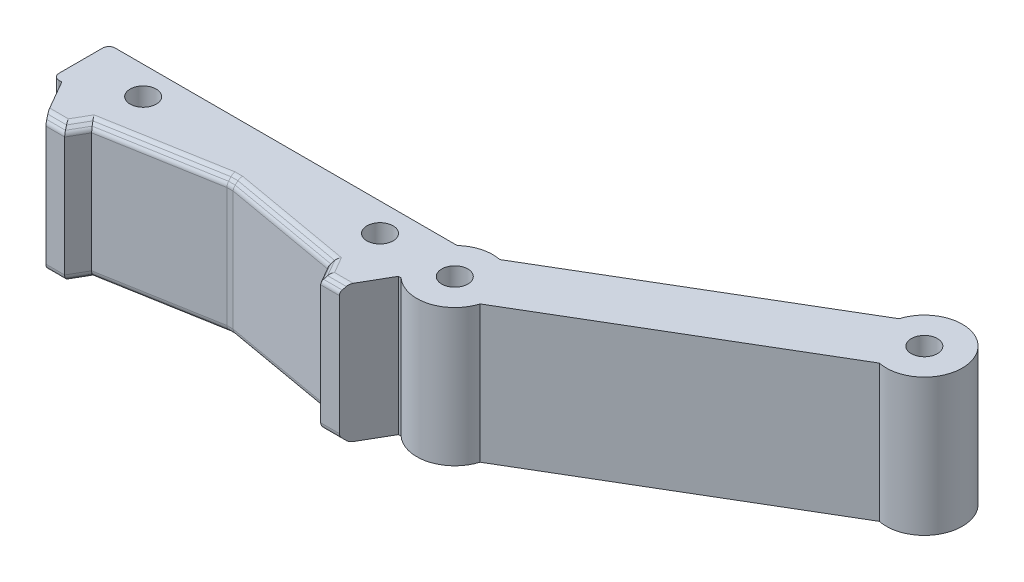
SolidWorks part; units mm, degrees
ref_plane "Plan de face" through (0, 0, 0) normal (0, 0, 1) x (1, 0, 0)
ref_plane "Plan de dessus" through (0, 0, 0) normal (0, 1, 0) x (1, 0, 0)
ref_plane "Plan de droite" through (0, 0, 0) normal (1, 0, 0) x (0, 0, -1)
sketch "Esquisse1" plane through (0, 0, 0) normal (0, 1, 0) x (1, 0, 0)
  line L0 (0, 0) -> (47.3392, 28) construction
  line L1 (0, 0) -> (-105.7032, 0) construction
  line L2 (-4.1183, -4.5) -> (-59, -4.5)
  line L9 (-60, -3.5) -> (-60, 3.5)
  line L10 (-59, 4.5) -> (-4.1183, 4.5)
  line L11 (5.8355, -1.7766) -> (46.0855, 22.0302)
  line L12 (41.5037, 29.7766) -> (1.2537, 5.9698)
  circle A0 centre (0, 0) radius 2.1
  circle A1 centre (47.3392, 28) radius 2.1
  arc A2 (5.8355, -1.7766) -> (-4.1183, -4.5) centre (0, 0) cw
  arc A3 (41.5037, 29.7766) -> (46.0855, 22.0302) centre (47.3392, 28) cw
  arc A4 (-4.1183, 4.5) -> (1.2537, 5.9698) centre (0, 0) cw
  arc A5 (-59, -4.5) -> (-60, -3.5) centre (-59, -3.5) cw
  arc A6 (-60, 3.5) -> (-59, 4.5) centre (-59, 3.5) cw
  circle A7 centre (-50, 0) radius 2.1
  circle A8 centre (-12, 0) radius 2.1
  dimension "D1" = 28
  dimension "D3" = 4.2
  dimension "D4" = 4
  dimension "D5" = 9
  dimension "D8" = 1
  dimension "D9" = 10
  dimension "D10" = 38
  dimension "D11" = 4.2
  dimension "D2" = 55
  dimension "D6" = 9
  dimension "D7" = 60
extrude "Boss.-Extru.1" add sketch "Esquisse1" along normal mid plane 22
sketch "Esquisse2" plane through (0, -11, 0) normal (0, -1, 0) x (1, 0, 0)
  line L0 (-31.5591, 4.5) -> (-31.5591, 18.0747) construction
  line L1 (-59, 4.5) -> (-4.1183, 4.5) construction
  line L2 (-12.6091, 7.7532) -> (-31.0591, 4.5)
  line L3 (-12.6091, 7.7532) -> (-11.0232, 10.5)
  line L4 (-11.0232, 10.5) -> (-8.0232, 10.5)
  line L5 (-8.0232, 10.5) -> (-4.5591, 4.5)
  line L6 (-4.5591, 4.5) -> (-31.0591, 4.5)
  line L7 (-58.5591, 4.5) -> (-32.0591, 4.5)
  line L8 (-55.095, 10.5) -> (-58.5591, 4.5)
  line L9 (-52.095, 10.5) -> (-55.095, 10.5)
  line L10 (-50.5092, 7.7532) -> (-52.095, 10.5)
  line L11 (-50.5092, 7.7532) -> (-32.0591, 4.5)
  dimension "D1" = 60
  dimension "D2" = 27
  dimension "D3" = 3
  dimension "D4" = 6
  dimension "D5" = 60
  dimension "D6" = 10
  dimension "D7" = 0.5
extrude "Boss.-Extru.2" add sketch "Esquisse2" against normal up to surface (22 mm away)
chamfer "Chanfrein1" distance 1 angle 45 14 edges at (-9.5232, -11, 10.5) (-53.595, -11, 10.5) (-51.3021, -11, 9.1266) (-41.2842, -11, 6.1266) (-31.5591, -11, 4.5) (-31.5591, 11, 4.5) (-21.8341, -11, 6.1266) (-11.8161, -11, 9.1266) (-53.595, 11, 10.5) (-51.3021, 11, 9.1266) (-41.2842, 11, 6.1266) (-21.8341, 11, 6.1266) (-11.8161, 11, 9.1266) (-9.5232, 11, 10.5)
fillet "Congé1" radius 1 28 edges at (-53.595, -10, 10.5) (-51.3021, -10, 9.1266) (-41.2842, -10, 6.1266) (-31.5591, -10, 4.5) (-21.8341, -10, 6.1266) (-11.8161, -10, 9.1266) (-9.5232, -10, 10.5) (-8.9459, -11, 9.5) (-11.211, -11, 8.1747) (-21.4739, -11, 5.1747) (-31.5591, -11, 3.5) (-41.6443, -11, 5.1747) (-51.9072, -11, 8.1747) (-54.1724, -11, 9.5) (-9.5232, 10, 10.5) (-11.8161, 10, 9.1266) (-21.8341, 10, 6.1266) (-31.5591, 10, 4.5) (-41.2842, 10, 6.1266) (-51.3021, 10, 9.1266) (-53.595, 10, 10.5) (-54.1724, 11, 9.5) (-51.9072, 11, 8.1747) (-41.6443, 11, 5.1747) (-31.5591, 11, 3.5) (-21.4739, 11, 5.1747) (-11.211, 11, 8.1747) (-8.9459, 11, 9.5)
